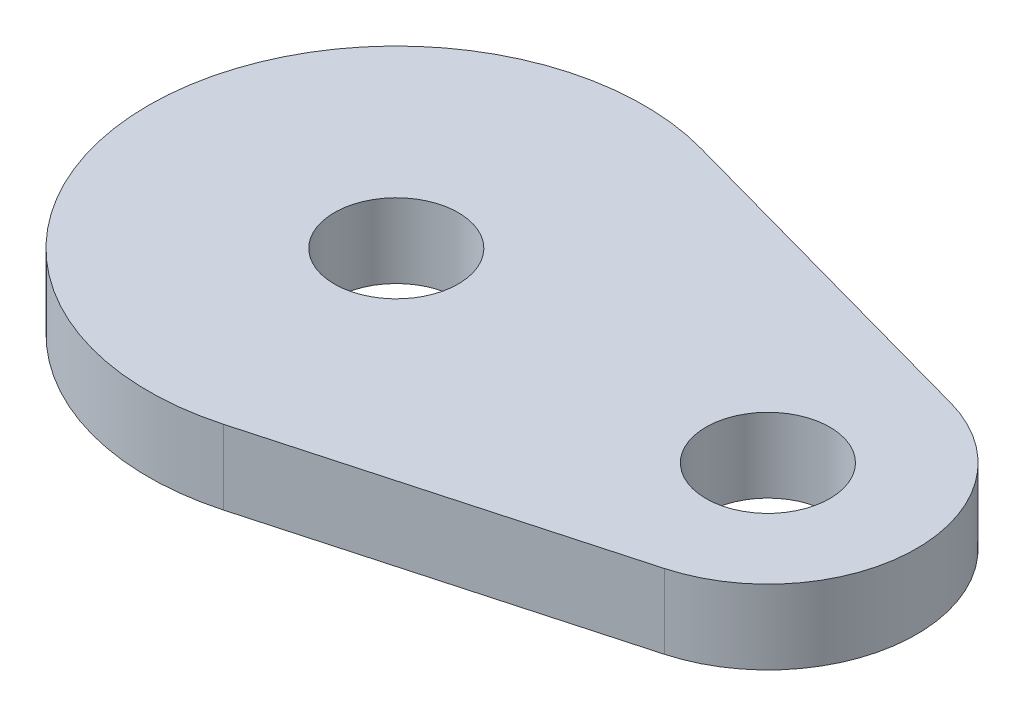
SolidWorks part; units mm, degrees
ref_plane "Front" through (0, 0, 0) normal (0, 0, 1) x (1, 0, 0)
ref_plane "Top" through (0, 0, 0) normal (0, 1, 0) x (1, 0, 0)
ref_plane "Right" through (0, 0, 0) normal (1, 0, 0) x (0, 0, -1)
sketch "Sketch1" plane through (0, 0, 0) normal (0, 1, 0) x (1, 0, 0)
  line L0 (2.6667, 9.6379) -> (16.6, 5.7827)
  line L1 (2.6667, -9.6379) -> (16.6, -5.7827)
  circle A0 centre (15, 0) radius 2.5
  circle A1 centre (0, 0) radius 2.5
  arc A2 (16.6, -5.7827) -> (16.6, 5.7827) centre (15, 0) ccw
  arc A3 (2.6667, 9.6379) -> (2.6667, -9.6379) centre (0, 0) ccw
extrude "Extrude1" add sketch "Sketch1" along normal blind 3
